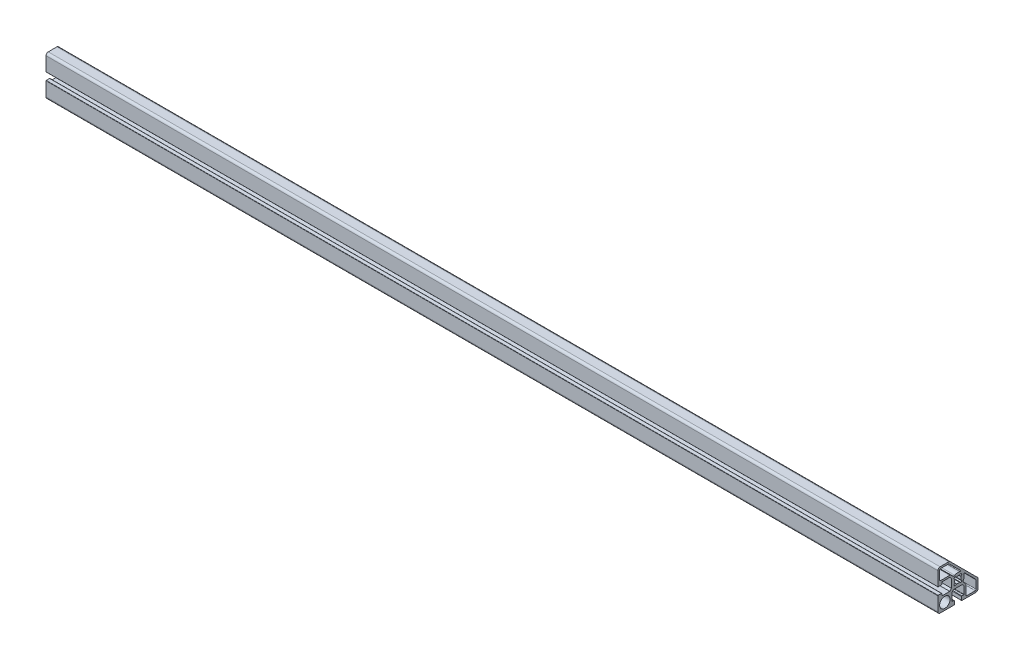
SolidWorks part; units mm, degrees
ref_plane "Front Plane" through (0, 0, 0) normal (0, 0, 1) x (1, 0, 0)
ref_plane "Top Plane" through (0, 0, 0) normal (0, 1, 0) x (1, 0, 0)
ref_plane "Right Plane" through (0, 0, 0) normal (1, 0, 0) x (0, 0, -1)
sketch "Sketch1" plane through (0, 0, 0) normal (0, 0, 1) x (1, 0, 0)
  line L0 (0, 0) -> (1000, 0)
  dimension "D1" = 1000
other "45-sarja 1.0027 45 - 45(1)"
ref_plane "Plane1" through (0, 0, 0) normal (1, 0, 0) x (0, 0, -1)
sketch "Model10" plane through (0, 0, 0) normal (1, 0, 0) x (0, 0, -1)
  line L0 (-7.7859, 8.2142) -> (-5.938, 6.3663)
  line L1 (2.9689, 7.3827) -> (-9.8555, 20.2071)
  line L2 (-10.5626, 20.5) -> (-19.5002, 20.5)
  line L3 (-20.5002, 19.5) -> (-20.5002, 9.8)
  line L4 (-19.5002, 8.8) -> (-9.2002, 8.8)
  line L5 (-3.3943, 4.3841) -> (-4.3842, 3.3941)
  line L6 (-4.3842, 2.9698) -> (-3.3634, 1.9491)
  line L7 (-3.3634, -1.9491) -> (-4.3842, -2.9698)
  line L8 (-4.3842, -3.3941) -> (-3.3943, -4.3841)
  line L9 (-2.97, -4.3841) -> (-1.9492, -3.3633)
  line L10 (1.9489, -3.3633) -> (2.9697, -4.3841)
  line L11 (3.394, -4.3841) -> (4.3839, -3.3941)
  line L12 (4.3839, -2.9698) -> (3.3631, -1.9491)
  line L13 (3.3631, 1.9491) -> (4.3839, 2.9698)
  line L14 (4.3839, 3.3941) -> (3.394, 4.3841)
  line L15 (2.9697, 4.3841) -> (1.9489, 3.3633)
  line L16 (-1.9492, 3.3633) -> (-2.97, 4.3841)
  line L17 (20.207, -9.8553) -> (7.3826, 2.969)
  line L18 (6.3661, -5.9379) -> (8.2141, -7.7858)
  line L19 (8.7998, -9.2) -> (8.7998, -19.5)
  line L20 (9.7998, -20.5) -> (19.4999, -20.5)
  line L21 (20.4999, -19.5) -> (20.4999, -10.5624)
  line L22 (-7.201, 4.8) -> (-7.201, -4.8)
  line L23 (-9.201, 6.8) -> (-7.201, 4.8)
  line L24 (-17.701, 6.8) -> (-9.201, 6.8)
  line L25 (-18.001, 4.6) -> (-18.001, 6.5)
  line L26 (-22.201, 4.1) -> (-18.501, 4.1)
  line L27 (-22.5002, 20) -> (-22.5002, 4.3775)
  line L28 (-10.3556, 22.5) -> (-20.0002, 22.5)
  line L29 (21.7676, -8.5878) -> (-8.5879, 21.7678)
  line L30 (22.4998, -20) -> (22.4998, -10.3555)
  line L31 (4.3755, -22.5) -> (19.9998, -22.5)
  line L32 (4.1, -18.501) -> (4.1, -22.201)
  line L33 (6.5, -18.001) -> (4.6, -18.001)
  line L34 (6.8, -9.201) -> (6.8, -17.701)
  line L35 (4.8, -7.201) -> (6.8, -9.201)
  line L36 (-4.8, -7.201) -> (4.8, -7.201)
  line L37 (-6.8, -9.201) -> (-4.8, -7.201)
  line L38 (-6.8, -17.701) -> (-6.8, -9.201)
  line L39 (-4.6, -18.001) -> (-6.5, -18.001)
  line L40 (-4.1, -22.201) -> (-4.1, -18.501)
  line L41 (-20.0001, -22.5) -> (-4.3755, -22.5)
  line L42 (-22.5002, -4.3775) -> (-22.5002, -20)
  line L43 (-18.501, -4.1) -> (-22.201, -4.1)
  line L44 (-18.001, -6.5) -> (-18.001, -4.6)
  line L45 (-9.201, -6.8) -> (-17.701, -6.8)
  line L46 (-7.201, -4.8) -> (-9.201, -6.8)
  arc A0 (-7.7859, 8.2142) -> (-9.2002, 8.8) centre (-9.2002, 6.8) ccw
  arc A1 (-5.938, 6.3663) -> (-3.5186, 6.0515) centre (-4.5238, 7.7805) ccw
  arc A2 (2.441, 6.5606) -> (-3.5186, 6.0515) centre (-0.0002, 0) ccw
  arc A3 (2.441, 6.5606) -> (2.9689, 7.3827) centre (2.6153, 7.0292) ccw
  arc A4 (-9.8555, 20.2071) -> (-10.5626, 20.5) centre (-10.5626, 19.5) ccw
  arc A5 (-19.5002, 20.5) -> (-20.5002, 19.5) centre (-19.5002, 19.5) ccw
  arc A6 (-20.5002, 9.8) -> (-19.5002, 8.8) centre (-19.5002, 9.8) ccw
  arc A7 (-2.97, 4.3841) -> (-3.3943, 4.3841) centre (-3.1821, 4.1719) ccw
  arc A8 (-4.3842, 3.3941) -> (-4.3842, 2.9698) centre (-4.1721, 3.182) ccw
  arc A9 (-3.3057, 1.6059) -> (-3.3634, 1.9491) centre (-3.5756, 1.7369) ccw
  arc A10 (-3.3057, 1.6059) -> (-3.3057, -1.6059) centre (-0.0002, 0) ccw
  arc A11 (-3.3634, -1.9491) -> (-3.3057, -1.6059) centre (-3.5756, -1.7369) ccw
  arc A12 (-4.3842, -2.9698) -> (-4.3842, -3.3941) centre (-4.1721, -3.182) ccw
  arc A13 (-3.3943, -4.3841) -> (-2.97, -4.3841) centre (-3.1821, -4.1719) ccw
  arc A14 (-1.606, -3.3056) -> (-1.9492, -3.3633) centre (-1.7371, -3.5754) ccw
  arc A15 (-1.606, -3.3056) -> (1.6057, -3.3056) centre (-0.0002, 0) ccw
  arc A16 (1.9489, -3.3633) -> (1.6057, -3.3056) centre (1.7368, -3.5754) ccw
  arc A17 (2.9697, -4.3841) -> (3.394, -4.3841) centre (3.1818, -4.1719) ccw
  arc A18 (4.3839, -3.3941) -> (4.3839, -2.9698) centre (4.1718, -3.182) ccw
  arc A19 (3.3054, -1.6059) -> (3.3631, -1.9491) centre (3.5753, -1.7369) ccw
  arc A20 (3.3054, -1.6059) -> (3.3054, 1.6059) centre (-0.0002, 0) ccw
  arc A21 (3.3631, 1.9491) -> (3.3054, 1.6059) centre (3.5753, 1.7369) ccw
  arc A22 (4.3839, 2.9698) -> (4.3839, 3.3941) centre (4.1718, 3.182) ccw
  arc A23 (3.394, 4.3841) -> (2.9697, 4.3841) centre (3.1818, 4.1719) ccw
  arc A24 (1.6057, 3.3056) -> (1.9489, 3.3633) centre (1.7368, 3.5754) ccw
  arc A25 (1.6057, 3.3056) -> (-1.606, 3.3056) centre (-0.0002, 0) ccw
  arc A26 (-1.9492, 3.3633) -> (-1.606, 3.3056) centre (-1.7371, 3.5754) ccw
  arc A27 (20.4999, -10.5624) -> (20.207, -9.8553) centre (19.4999, -10.5624) ccw
  arc A28 (7.3826, 2.969) -> (6.5604, 2.4411) centre (7.029, 2.6155) ccw
  arc A29 (6.0514, -3.5184) -> (6.5604, 2.4411) centre (-0.0002, 0) ccw
  arc A30 (6.0514, -3.5184) -> (6.3661, -5.9379) centre (7.7804, -4.5237) ccw
  arc A31 (8.7998, -9.2) -> (8.2141, -7.7858) centre (6.7998, -9.2) ccw
  arc A32 (8.7998, -19.5) -> (9.7998, -20.5) centre (9.7998, -19.5) ccw
  arc A33 (19.4999, -20.5) -> (20.4999, -19.5) centre (19.4999, -19.5) ccw
  circle A34 centre (-14.6502, -14.65) radius 5.85
  arc A35 (-17.701, 6.8) -> (-18.001, 6.5) centre (-17.701, 6.5) ccw
  arc A36 (-18.501, 4.1) -> (-18.001, 4.6) centre (-18.501, 4.6) ccw
  arc A37 (-22.5002, 4.3775) -> (-22.201, 4.1) centre (-22.201, 4.4) ccw
  arc A38 (-20.0002, 22.5) -> (-22.5002, 20) centre (-20.0002, 20) ccw
  arc A39 (-8.5879, 21.7678) -> (-10.3556, 22.5) centre (-10.3556, 20.0001) ccw
  arc A40 (22.4998, -10.3555) -> (21.7676, -8.5878) centre (19.9999, -10.3555) ccw
  arc A41 (19.9998, -22.5) -> (22.4998, -20) centre (19.9998, -20) ccw
  arc A42 (4.1, -22.201) -> (4.3755, -22.5) centre (4.4, -22.201) ccw
  arc A43 (4.6, -18.001) -> (4.1, -18.501) centre (4.6, -18.501) ccw
  arc A44 (6.5, -18.001) -> (6.8, -17.701) centre (6.5, -17.701) ccw
  arc A45 (-6.8, -17.701) -> (-6.5, -18.001) centre (-6.5, -17.701) ccw
  arc A46 (-4.1, -18.501) -> (-4.6, -18.001) centre (-4.6, -18.501) ccw
  arc A47 (-4.3755, -22.5) -> (-4.1, -22.201) centre (-4.4, -22.201) ccw
  arc A48 (-22.5002, -20) -> (-20.0001, -22.5) centre (-20.0001, -20) ccw
  arc A49 (-22.201, -4.1) -> (-22.5002, -4.3775) centre (-22.201, -4.4) ccw
  arc A50 (-18.001, -4.6) -> (-18.501, -4.1) centre (-18.501, -4.6) ccw
  arc A51 (-18.001, -6.5) -> (-17.701, -6.8) centre (-17.701, -6.5) ccw
  point P146 (6.5899, 6.59)
  point P147 (0, 0)
  point P148 (-22.5002, -22.5)
  point P149 (22.4998, -22.5)
  point P150 (-22.5002, 22.5)
  point P151 (-22.5002, 0)
  point P152 (0, 0)
